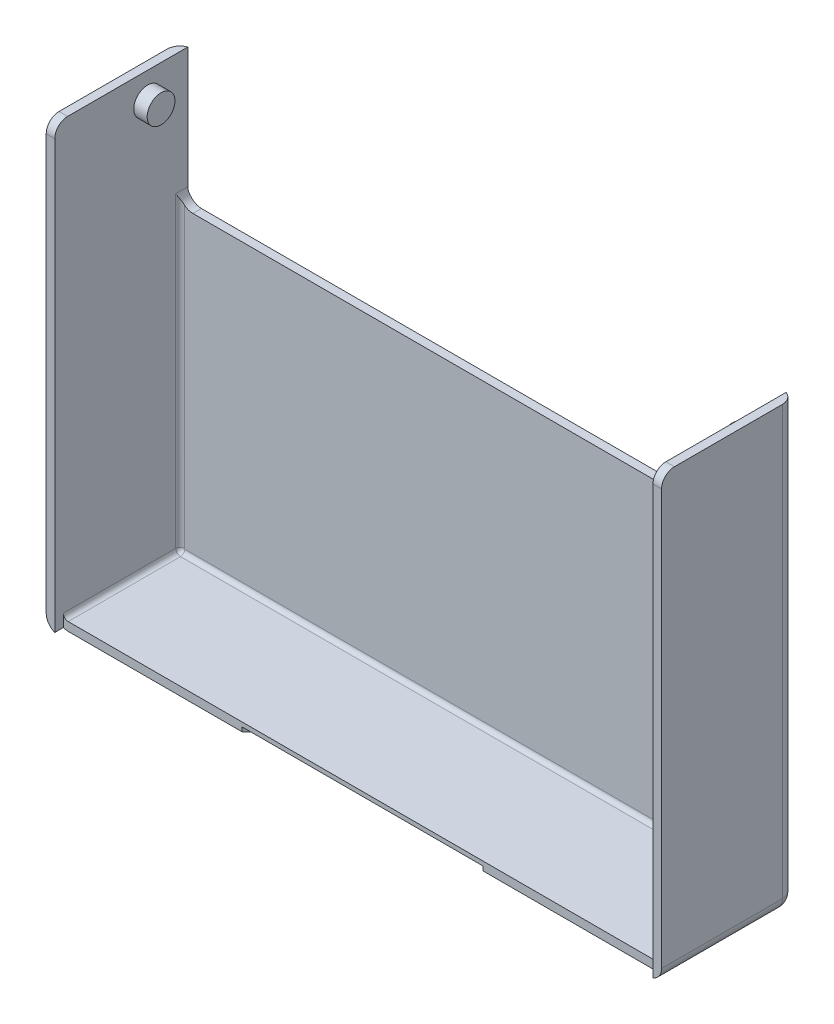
SolidWorks part; units mm, degrees
ref_plane "Front" through (0, 0, 0) normal (0, 0, 1) x (1, 0, 0)
ref_plane "Top" through (0, 0, 0) normal (0, 1, 0) x (1, 0, 0)
ref_plane "Right" through (0, 0, 0) normal (1, 0, 0) x (0, 0, -1)
sketch "Sketch1" plane through (0, 0, 0) normal (0, 0, 1) x (1, 0, 0)
  line L1 (-36.5125, 0) -> (36.5125, 0)
  line L2 (-36.5125, 0) -> (-36.5125, 52.3875)
  line L3 (-36.5125, 52.3875) -> (36.5125, 52.3875)
  line L4 (36.5125, 0) -> (36.5125, 52.3875)
  dimension "D1" = 73.025
  dimension "D2" = 52.3875
extrude "Extrude1" add sketch "Sketch1" along normal mid plane 15.875
fillet "Fillet1" radius 1.5875
fillet "Fillet3" radius 1.524
shell "Shell1" thickness 1.016
sketch "Sketch2" plane through (0, 0, 7.9375) normal (0, 0, 1) x (1, 0, 0)
  line L0 (-35.4965, 51.3715) -> (-35.4965, 1.5875) construction
  line L1 (-35.4965, 36.5125) -> (35.4965, 36.5125)
  line L2 (-35.4965, 36.5125) -> (-35.4965, 52.3875)
  line L3 (-35.4965, 52.3875) -> (35.4965, 52.3875)
  line L4 (35.4965, 36.5125) -> (35.4965, 52.3875)
  line L5 (35.4965, 1.5875) -> (35.4965, 51.3715) construction
  line L6 (36.5125, 52.3875) -> (-36.5125, 52.3875) construction
  dimension "D1" = 15.875
extrude "Cut-Extrude1" cut sketch "Sketch2" against normal through all
fillet "Fillet2" radius 1.524
sketch "Sketch3" plane through (-35.4965, 0, 0) normal (1, 0, 0) x (0, 0, -1)
  line L4 (7.8503, 52.3875) -> (7.8503, 38.0365) construction
  line L5 (7.8503, 52.3875) -> (-6.4135, 52.3875) construction
  circle A0 centre (3.0878, 49.2125) radius 1.651
  dimension "D1" = 3.302
  dimension "D3" = 3.175
  dimension "D4" = 4.7625
extrude "Extrude2" add sketch "Sketch3" along normal blind 1.5875
mirror "Mirror1" about plane through (0, 0, 0) normal (1, 0, 0)
sketch "Sketch5" plane through (0, 0, 0) normal (0, -1, 0) x (1, 0, 0)
  line L0 (-35.4965, -6.4135) -> (-35.4965, 7.9375) construction
  line L1 (35.4965, 7.9375) -> (-35.4965, 7.9375)
  line L2 (35.4965, 7.9375) -> (35.4965, 6.9215)
  line L3 (35.4965, 6.9215) -> (-35.4965, 6.9215)
  line L4 (-35.4965, 7.9375) -> (-35.4965, 6.9215)
  dimension "D1" = 1.016
extrude "Cut-Extrude3" cut sketch "Sketch5" against normal through all
sketch "Sketch4" plane through (0, 0, 0) normal (0, -1, 0) x (1, 0, 0)
  line L0 (14.2875, 6.9215) -> (11.5589, 4.1929)
  line L1 (-34.925, 7.9375) -> (34.925, 7.9375) construction
  line L2 (10.4812, 3.7465) -> (-10.4812, 3.7465)
  line L3 (-11.5589, 4.1929) -> (-14.2875, 6.9215)
  line L4 (0, 7.9375) -> (0, -12.4122) construction
  line L5 (14.2875, 6.9215) -> (-14.2875, 6.9215)
  line L6 (-34.925, 6.9215) -> (34.925, 6.9215) construction
  arc A0 (11.5589, 4.1929) -> (10.4812, 3.7465) centre (10.4812, 5.2705) cw
  arc A1 (-10.4812, 3.7465) -> (-11.5589, 4.1929) centre (-10.4812, 5.2705) cw
  point P10 (11.1125, 3.7465)
  point P13 (-11.1125, 3.7465)
  dimension "D4" = 1.524
  dimension "D1" = 3.175
  dimension "D2" = 3.175
  dimension "D3" = 28.575
extrude "Cut-Extrude2" cut sketch "Sketch4" against normal blind 0.508
